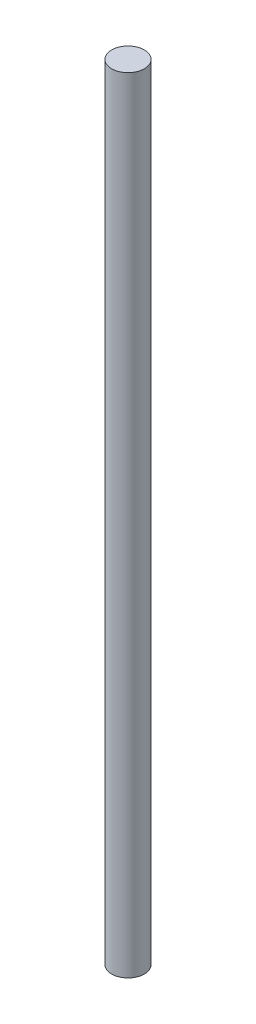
SolidWorks part; units mm, degrees
ref_plane "Front" through (0, 0, 0) normal (0, 0, 1) x (1, 0, 0)
ref_plane "Top" through (0, 0, 0) normal (0, 1, 0) x (1, 0, 0)
ref_plane "Right" through (0, 0, 0) normal (1, 0, 0) x (0, 0, -1)
sketch "Sketch1" plane through (0, 0, 0) normal (0, 1, 0) x (1, 0, 0)
  circle A0 centre (0, 0) radius 1.5875
  dimension "D1" = 3.175
extrude "Boss-Extrude1" add sketch "Sketch1" along normal blind 76.2
